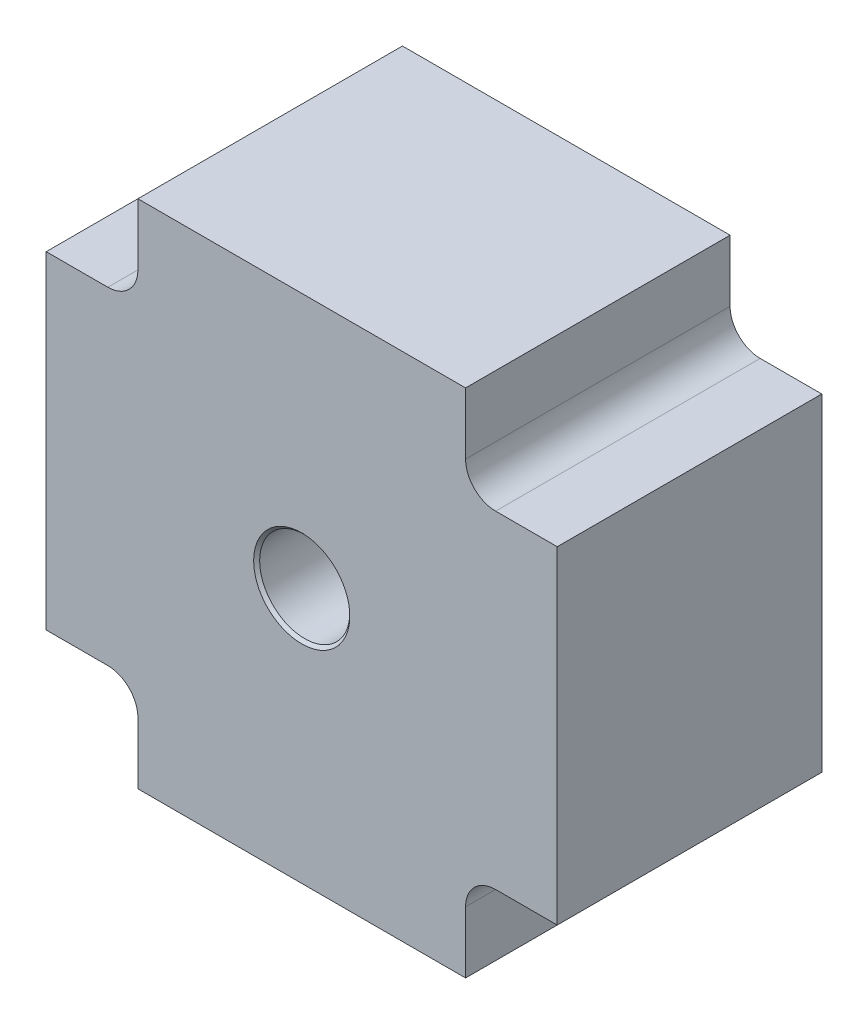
SolidWorks part; units mm, degrees
ref_plane "前视基准面" through (0, 0, 0) normal (0, 0, 1) x (1, 0, 0)
ref_plane "上视基准面" through (0, 0, 0) normal (0, 1, 0) x (1, 0, 0)
ref_plane "右视基准面" through (0, 0, 0) normal (1, 0, 0) x (0, 0, -1)
sketch "草图1" plane through (0, 0, 0) normal (0, 0, 1) x (1, 0, 0)
  line L0 (73.6849, 0) -> (-83.1554, 0) construction
  line L1 (27.25, 42.5) -> (-27.25, 42.5)
  line L2 (27.25, 42.5) -> (27.25, 27.25)
  line L3 (27.25, -42.5) -> (-27.25, -42.5)
  line L4 (-27.25, 42.5) -> (-27.25, 27.25)
  line L5 (27.25, 42.5) -> (-27.25, -42.5) construction
  line L6 (27.25, -42.5) -> (-27.25, 42.5) construction
  line L7 (0, -54.7285) -> (0, 60.804) construction
  line L8 (-27.25, 27.25) -> (-42.5, 27.25)
  line L9 (42.5, -27.25) -> (27.25, -27.25)
  line L10 (42.5, -27.25) -> (42.5, 27.25)
  line L11 (42.5, 27.25) -> (27.25, 27.25)
  line L12 (-42.5, -27.25) -> (-42.5, 27.25)
  line L13 (42.5, -27.25) -> (-42.5, 27.25) construction
  line L14 (42.5, 27.25) -> (-42.5, -27.25) construction
  line L15 (-27.25, -27.25) -> (-27.25, -42.5)
  line L16 (-27.25, -27.25) -> (-42.5, -27.25)
  line L17 (27.25, -27.25) -> (27.25, -42.5)
  point P0 (0, 0)
  point P10 (0, 0)
  dimension "D1" = 54.5
  dimension "D2" = 85
  dimension "D3" = 54.5
  dimension "D4" = 85
extrude "凸台-拉伸1" add sketch "草图1" along normal blind 44
sketch "草图3" plane through (0, 0, 44) normal (0, 0, 1) x (1, 0, 0)
  circle A0 centre (0, 0) radius 7.5
  dimension "D1" = 15
extrude "切除-拉伸2" cut sketch "草图3" against normal through all
chamfer "倒角3" distance 0.5 angle 45 2 edges at (7.5, 0, 0) (7.5, 0, 44)
fillet "圆角1" radius 5 4 edges at (-27.25, -27.25, 22) (27.25, -27.25, 22) (27.25, 27.25, 22) (-27.25, 27.25, 22)
